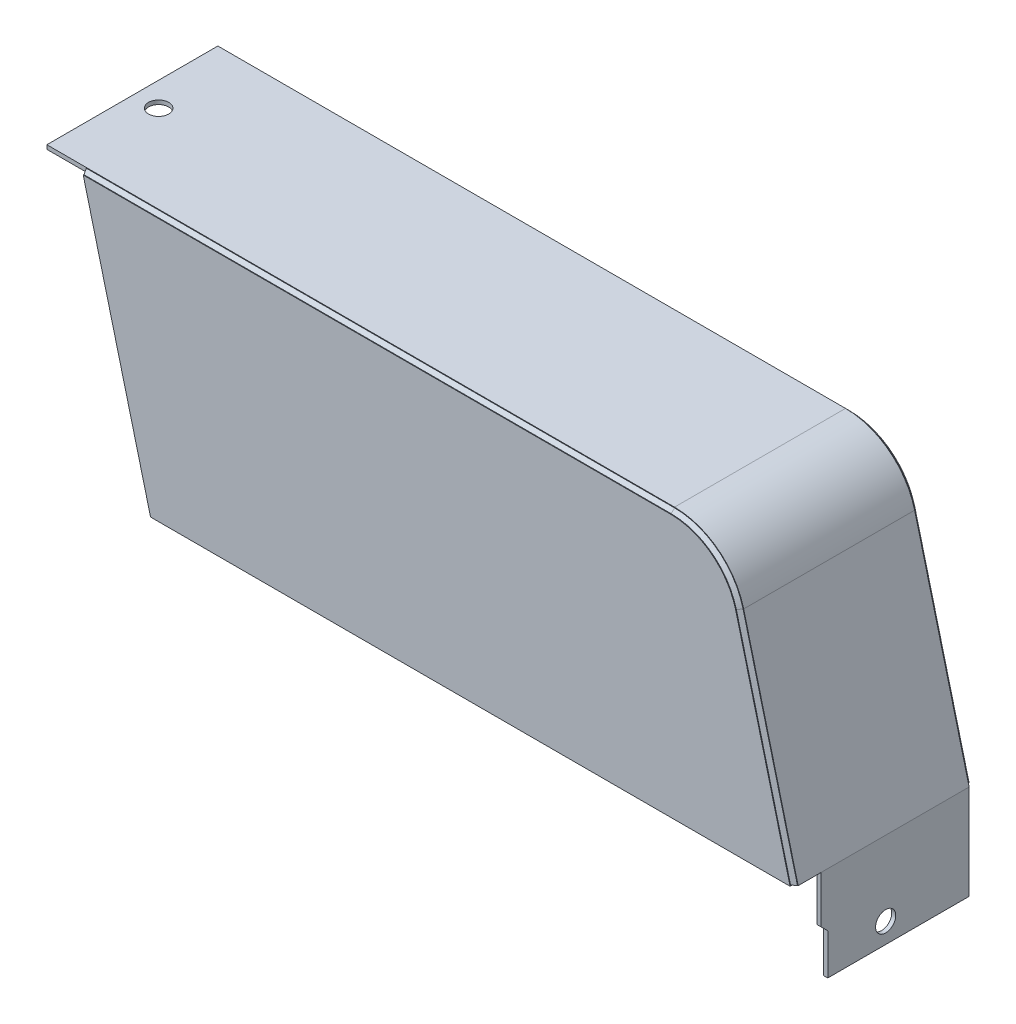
SolidWorks part; units mm, degrees
ref_plane "Plan de face" through (0, 0, 0) normal (0, 0, 1) x (1, 0, 0)
ref_plane "Plan de dessus" through (0, 0, 0) normal (0, 1, 0) x (1, 0, 0)
ref_plane "Plan de droite" through (0, 0, 0) normal (1, 0, 0) x (0, 0, -1)
mirrored part "144 - carter droit - bande de frein_Rendre symétrique"
other "<144 - carter droit - bande de frein>-<Extrusion2>"
other "<144 - carter droit - bande de frein>-<Extrusion3>"
other "<144 - carter droit - bande de frein>-<Cordon de soudure d'angle3>"
other "<144 - carter droit - bande de frein>-<Enlèv. mat.-Extru.2[1]>"
other "<144 - carter droit - bande de frein>-<Enlèv. mat.-Extru.2[2]>"
